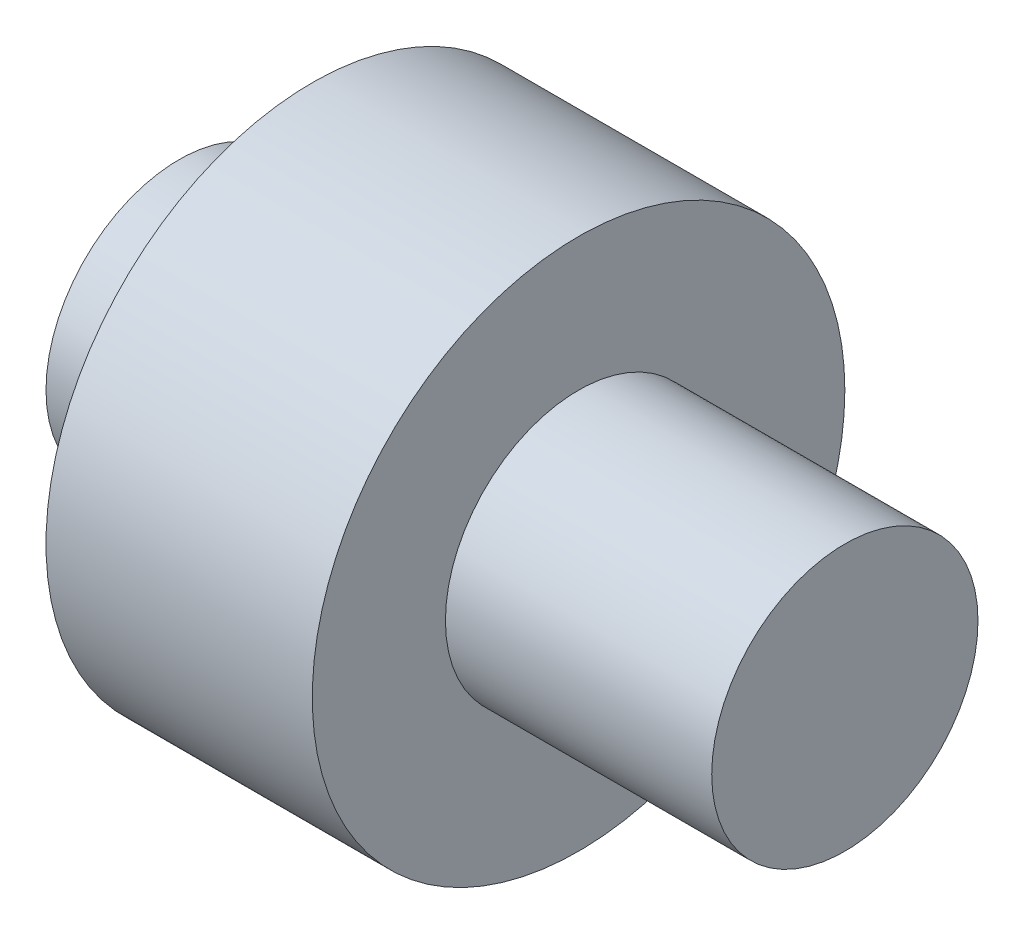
SolidWorks part; units mm, degrees
ref_plane "Front Plane" through (0, 0, 0) normal (0, 0, 1) x (1, 0, 0)
ref_plane "Top Plane" through (0, 0, 0) normal (0, 1, 0) x (1, 0, 0)
ref_plane "Right Plane" through (0, 0, 0) normal (1, 0, 0) x (0, 0, -1)
sketch "Sketch1" plane through (0, 0, 0) normal (1, 0, 0) x (0, 0, -1)
  circle A0 centre (0, 0) radius 10
  dimension "D1" = 20
extrude "Boss-Extrude1" add sketch "Sketch1" along normal blind 10
sketch "Sketch2" plane through (0, 0, 0) normal (-1, 0, 0) x (0, 0, 1)
  circle A0 centre (0, 0) radius 5
  dimension "D1" = 10
extrude "Boss-Extrude2" add sketch "Sketch2" along normal blind 5
sketch "Sketch3" plane through (10, 0, 0) normal (1, 0, 0) x (0, 0, -1)
  circle A0 centre (0, 0) radius 5
  dimension "D1" = 10
extrude "Boss-Extrude3" add sketch "Sketch3" along normal blind 10
